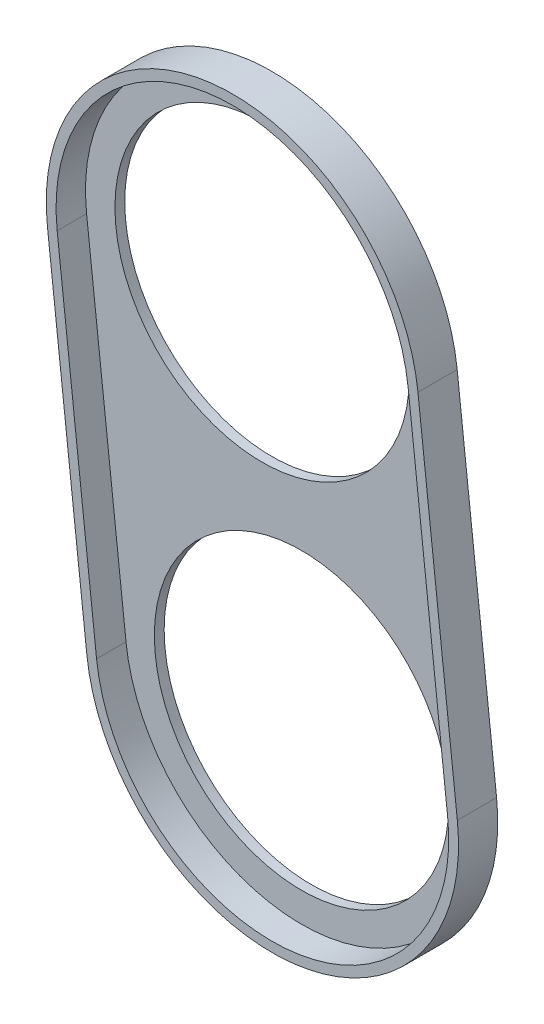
SolidWorks part; units mm, degrees
ref_plane "Plan de face" through (0, 0, 0) normal (0, 0, 1) x (1, 0, 0)
ref_plane "Plan de dessus" through (0, 0, 0) normal (0, 1, 0) x (1, 0, 0)
ref_plane "Plan de droite" through (0, 0, 0) normal (1, 0, 0) x (0, 0, -1)
sketch "Esquisse1" plane through (0, 0, 0) normal (0, 0, 1) x (1, 0, 0)
  line L0 (-47.2034, -5.2998) -> (-37.1617, -94.7379)
  line L1 (47.2034, 5.2998) -> (57.2452, -84.1382)
  arc A0 (47.2034, 5.2998) -> (-47.2034, -5.2998) centre (0, 0) ccw
  arc A1 (-37.1617, -94.7379) -> (57.2452, -84.1382) centre (10.0418, -89.438) ccw
  dimension "D1" = 95
  dimension "D2" = 95
extrude "Boss.-Extru.1" add sketch "Esquisse1" along normal blind 10
sketch "Esquisse3" plane through (0, 0, 10) normal (0, 0, 1) x (1, 0, 0)
  line L4 (54.7608, -84.4172) -> (44.719, 5.0209)
  line L5 (-44.719, -5.0209) -> (-34.6773, -94.4589)
  line L6 (54.7608, -84.4172) -> (44.719, 5.0209)
  line L7 (-44.719, -5.0209) -> (-34.6773, -94.4589)
  arc A4 (-34.6773, -94.4589) -> (54.7608, -84.4172) centre (10.0418, -89.438) ccw
  arc A5 (44.719, 5.0209) -> (-44.719, -5.0209) centre (0, 0) ccw
  arc A6 (-34.6773, -94.4589) -> (54.7608, -84.4172) centre (10.0418, -89.438) ccw
  arc A7 (44.719, 5.0209) -> (-44.719, -5.0209) centre (0, 0) ccw
  dimension "D1" = 2.5
extrude "Enlèv. mat.-Extru.1" cut sketch "Esquisse3" against normal offset from surface (7.5 mm away) 2.5
sketch "Esquisse4" plane through (0, 0, 2.5) normal (0, 0, 1) x (1, 0, 0)
  circle A1 centre (0, 0) radius 37.5
  circle A2 centre (10.0418, -89.438) radius 37.5 construction
  circle A3 centre (10.0418, -89.438) radius 37.5
  circle A4 centre (0, 0) radius 37.5 construction
extrude "Enlèv. mat.-Extru.2" cut sketch "Esquisse4" against normal through all
